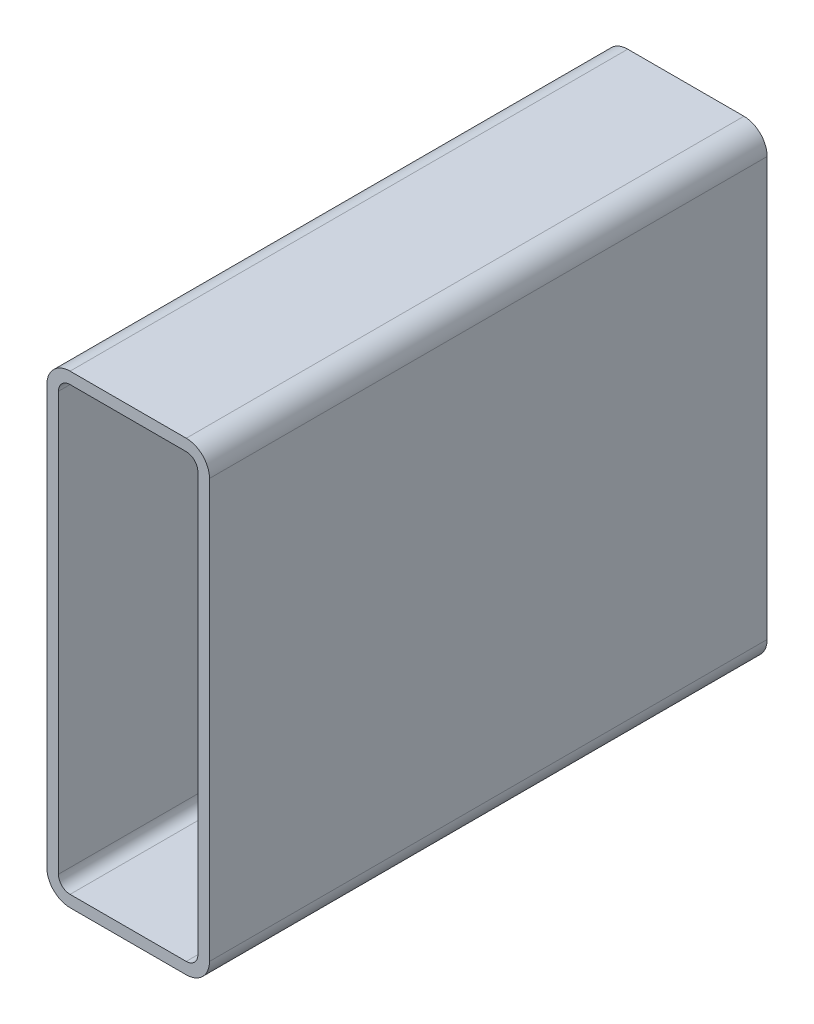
SolidWorks part; units mm, degrees
ref_plane "Front Plane" through (0, 0, 0) normal (0, 0, 1) x (1, 0, 0)
ref_plane "Top Plane" through (0, 0, 0) normal (0, 1, 0) x (1, 0, 0)
ref_plane "Right Plane" through (0, 0, 0) normal (1, 0, 0) x (0, 0, -1)
sketch "Sketch1" plane through (0, 0, 0) normal (0, 0, 1) x (1, 0, 0)
sketch_block_instance "HSS10x3.5x0.250-1"
sketch_block "HSS10x3.5x0.250"
extrude "Boss-Extrude1" add sketch "Sketch1" along normal blind 304.8
